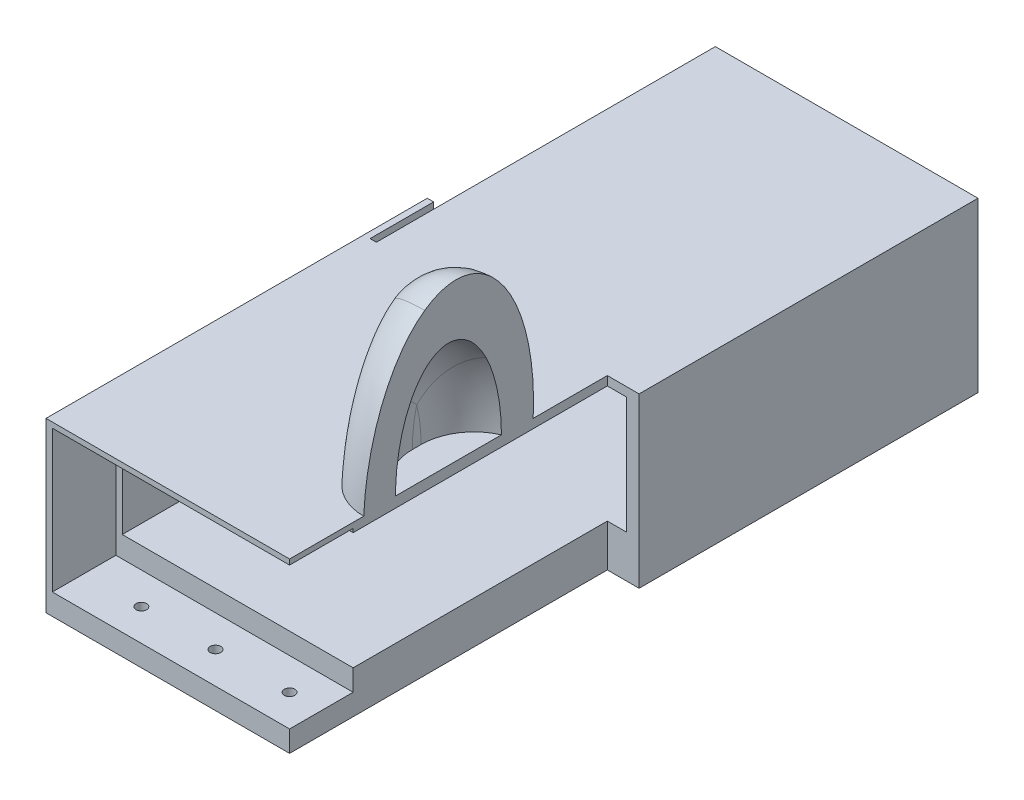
SolidWorks part; units mm, degrees
ref_plane "前视基准面" through (0, 0, 0) normal (0, 0, 1) x (1, 0, 0)
ref_plane "上视基准面" through (0, 0, 0) normal (0, 1, 0) x (1, 0, 0)
ref_plane "右视基准面" through (0, 0, 0) normal (1, 0, 0) x (0, 0, -1)
sketch "草图1" plane through (0, 0, 1950) normal (0, 0, 1) x (1, 0, 0)
  line L0 (7.6976, 142.5174) -> (-122.3024, 142.5174) construction
  line L1 (-122.3024, 142.5174) -> (7.6976, 142.5174)
  line L2 (-122.3024, 142.5174) -> (-122.3024, 63.0247)
  line L3 (-122.3024, 63.0247) -> (7.6976, 63.0247)
  line L4 (7.6976, 142.5174) -> (7.6976, 63.0247)
  line L5 (-119.3024, 140.7662) -> (4.6976, 140.7662)
  line L6 (-119.3024, 140.7662) -> (-119.3024, 73.0247)
  line L7 (-119.3024, 73.0247) -> (4.6976, 73.0247)
  line L8 (4.6976, 140.7662) -> (4.6976, 73.0247)
  dimension "D1" = 0
extrude "凸台-拉伸1" add sketch "草图1" along normal up to surface (30 mm away)
sketch "草图2" plane through (0, 0, 1980) normal (0, 0, 1) x (1, 0, 0)
  line L1 (-122.3024, 142.5174) -> (7.6976, 142.5174)
  line L2 (-122.3024, 142.5174) -> (-122.3024, 63.0247)
  line L3 (-122.3024, 63.0247) -> (7.6976, 63.0247)
  line L4 (7.6976, 142.5174) -> (7.6976, 63.0247)
  line L9 (-116.3024, 138.2662) -> (1.6976, 138.2662)
  line L10 (-116.3024, 138.2662) -> (-116.3024, 83.0247)
  line L11 (-116.3024, 83.0247) -> (1.6976, 83.0247)
  line L12 (1.6976, 138.2662) -> (1.6976, 83.0247)
extrude "凸台-拉伸2" add sketch "草图2" along normal blind 250
ref_plane "基准面4" through (-116.3024, 83.0247, 2230) normal (1, 0, 0) x (0, 0, -1)
sketch "草图5" plane through (0, 0, 2230) normal (0, 0, 1) x (1, 0, 0)
  line L1 (-122.3024, 142.5174) -> (7.6976, 142.5174)
  line L2 (-122.3024, 142.5174) -> (-122.3024, 63.0247)
  line L3 (-122.3024, 63.0247) -> (7.6976, 63.0247)
  line L4 (7.6976, 142.5174) -> (7.6976, 63.0247)
  line L5 (-119.3024, 140.0174) -> (4.6976, 140.0174)
  line L6 (-119.3024, 140.0174) -> (-119.3024, 73.0247)
  line L7 (-119.3024, 73.0247) -> (4.6976, 73.0247)
  line L8 (4.6976, 140.0174) -> (4.6976, 73.0247)
  dimension "D1" = 10
  dimension "D2" = 3
  dimension "D3" = 2.5
  dimension "D4" = 3
extrude "凸台-拉伸4" add sketch "草图5" along normal blind 30
sketch "草图6" plane through (0, 63.0247, 0) normal (0, -1, 0) x (1, 0, 0)
  line L0 (-122.3024, 2260) -> (7.6976, 2260) construction
  line L1 (7.6976, 2260) -> (7.6976, 1950) construction
  circle A0 centre (-92.3024, 2245) radius 5.5
  circle A1 centre (-57.3024, 2245) radius 5.5
  circle A2 centre (-22.3024, 2245) radius 5.5
  circle A3 centre (-22.3024, 1405) radius 5.5 construction
  circle A4 centre (-92.3024, 1405) radius 5.5 construction
  dimension "D1" = 11
  dimension "D2" = 11
  dimension "D3" = 11
  dimension "D4" = 15
  dimension "D5" = 15
  dimension "D6" = 15
  dimension "D7" = 0
  dimension "D8" = 65
  dimension "D9" = 0
extrude "切除-拉伸1" cut sketch "草图6" against normal blind 2.5
sketch "草图7" plane through (0, 65.5247, 0) normal (0, -1, 0) x (1, 0, 0)
  circle A0 centre (-92.3024, 2245) radius 2.5
  circle A1 centre (-57.3024, 2245) radius 2.5
  circle A2 centre (-22.3024, 2245) radius 2.5
  dimension "D1" = 5
  dimension "D2" = 5
  dimension "D3" = 5
extrude "切除-拉伸2" cut sketch "草图7" against normal up to next
sketch "草图8" plane through (0, 63.0247, 0) normal (0, -1, 0) x (1, 0, 0)
  line L0 (-122.3024, 1950) -> (7.6976, 1950) construction
  line L1 (7.6976, 2260) -> (7.6976, 1950) construction
  circle A0 centre (-92.3024, 1965) radius 5.5
  circle A1 centre (-57.3024, 1965) radius 5.5
  circle A2 centre (-22.3024, 1965) radius 5.5
  circle A3 centre (-22.3024, 2245) radius 5.5 construction
  circle A4 centre (-92.3024, 2245) radius 5.5 construction
  dimension "D1" = 11
  dimension "D2" = 11
  dimension "D3" = 11
  dimension "D4" = 15
  dimension "D5" = 15
  dimension "D6" = 15
  dimension "D7" = 65
  dimension "D8" = 0
  dimension "D9" = 0
extrude "切除-拉伸3" cut sketch "草图8" against normal blind 2.5
sketch "草图9" plane through (0, 65.5247, 0) normal (0, -1, 0) x (1, 0, 0)
  circle A0 centre (-92.3024, 1965) radius 2.5
  circle A1 centre (-57.3024, 1965) radius 2.5
  circle A2 centre (-22.2811, 1974.9353) radius 2.5
  dimension "D1" = 5
  dimension "D2" = 5
  dimension "D3" = 5
extrude "切除-拉伸4" cut sketch "草图9" against normal up to next
sketch "草图10" plane through (0, 142.5174, 0) normal (0, 1, 0) x (1, 0, 0)
  line L0 (7.6976, -1950) -> (-122.3024, -1950) construction
  line L1 (-122.3024, -1950) -> (-116.3024, -1950)
  line L2 (-122.3024, -1950) -> (-122.3024, -2080)
  line L3 (-122.3024, -2080) -> (-116.3024, -2080)
  line L4 (-116.3024, -1950) -> (-116.3024, -2080)
  line L6 (-122.3024, -2260) -> (-122.3024, -1950) construction
  dimension "D1" = 130
  dimension "D2" = 6
  dimension "D3" = 0
extrude "切除-拉伸5" cut sketch "草图10" against normal offset from surface (74.4927 mm away) 5
sketch "草图11" plane through (0, 142.5174, 0) normal (0, 1, 0) x (1, 0, 0)
  line L1 (-116.3024, -2080) -> (-119.3024, -2080)
  line L2 (-116.3024, -2080) -> (-116.3024, -2110)
  line L3 (-116.3024, -2110) -> (-119.3024, -2110)
  line L4 (-119.3024, -2080) -> (-119.3024, -2110)
  dimension "D1" = 3
  dimension "D2" = 30
extrude "切除-拉伸6" cut sketch "草图11" against normal offset from surface (74.4927 mm away) 5
sketch "草图12" plane through (0, 68.0247, 0) normal (0, 1, 0) x (1, 0, 0)
  line L1 (-119.3024, -2080) -> (-122.3024, -2080)
  line L2 (-119.3024, -2080) -> (-119.3024, -1950)
  line L3 (-119.3024, -1950) -> (-122.3024, -1950)
  line L4 (-122.3024, -2080) -> (-122.3024, -1950)
extrude "凸台-拉伸5" add sketch "草图12" along normal up to surface (15 mm away)
sketch "草图14" plane through (7.6976, 0, 0) normal (1, 0, 0) x (0, 0, -1)
  line L0 (-2260, 63.0247) -> (-1950, 63.0247) construction
  line L1 (-2260, 142.5174) -> (-2110, 142.5174)
  line L2 (-2260, 142.5174) -> (-2260, 63.0247)
  line L3 (-2260, 63.0247) -> (-2110, 63.0247)
  line L4 (-2110, 142.5174) -> (-2110, 63.0247)
  dimension "D1" = 150
extrude "切除-拉伸10" cut sketch "草图14" against normal blind 15
sketch "草图15" plane through (-7.3024, 0, 0) normal (1, 0, 0) x (0, 0, -1)
  line L0 (-2110, 142.5174) -> (-2260, 142.5174) construction
  line L1 (-2225, 142.5174) -> (-2145, 142.5174)
  ellipse E0 centre (-2185, 142.5174) end of major axis (-2179.989, 217.3498) minor radius 39.936 (-2225, 142.5174) -> (-2145, 142.5174) cw
  dimension "D1" = 75
  dimension "D2" = 40
extrude "凸台-拉伸6" add sketch "草图15" against normal blind 25
sketch "草图20" plane through (-7.3024, 0, 0) normal (1, 0, 0) x (0, 0, -1)
  line L0 (-2110, 138.2662) -> (-2230, 138.2662) construction
  line L1 (-2209.993, 143.2662) -> (-2159.993, 143.2662)
  ellipse E0 centre (-2184.993, 143.2662) end of major axis (-2184.993, 93.2662) minor radius 25 (-2209.993, 143.2662) -> (-2159.993, 143.2662) cw
  dimension "D1" = 5
  dimension "D2" = 50
  dimension "D3" = 50
  dimension "D4" = 40
extrude "切除-拉伸11" cut sketch "草图20" against normal blind 15
fillet "圆角1" radius 25 2 edges at (-32.3024, 217.3974, 2181.4121) (-22.3024, 193.2662, 2184.993)
sketch "草图21" plane through (0, 63.0247, 0) normal (0, -1, 0) x (-1, 0, 0)
  circle A0 centre (99.8024, -2040.75) radius 1.6
  circle A1 centre (14.8024, -2040.75) radius 1.6
extrude "切除-拉伸12" cut sketch "草图21" against normal up to next
